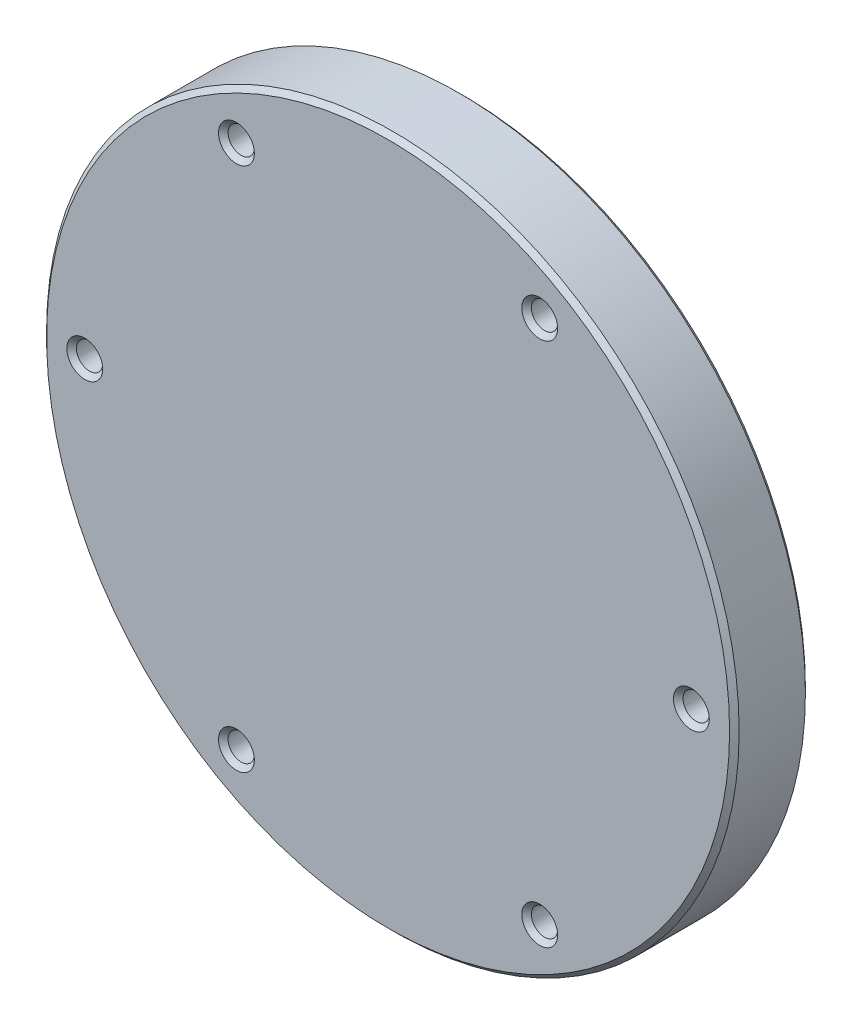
SolidWorks part; units mm, degrees
other "<WTE2-P-END-CAP-R2>-<Chamfer1>"
ref_plane "Front Plane" through (0, 0, 0) normal (0, 0, 1) x (1, 0, 0)
ref_plane "Top Plane" through (0, 0, 0) normal (0, 1, 0) x (1, 0, 0)
ref_plane "Right Plane" through (0, 0, 0) normal (1, 0, 0) x (0, 0, -1)
inserted part "WTE2-P-END-CAP-R2"
